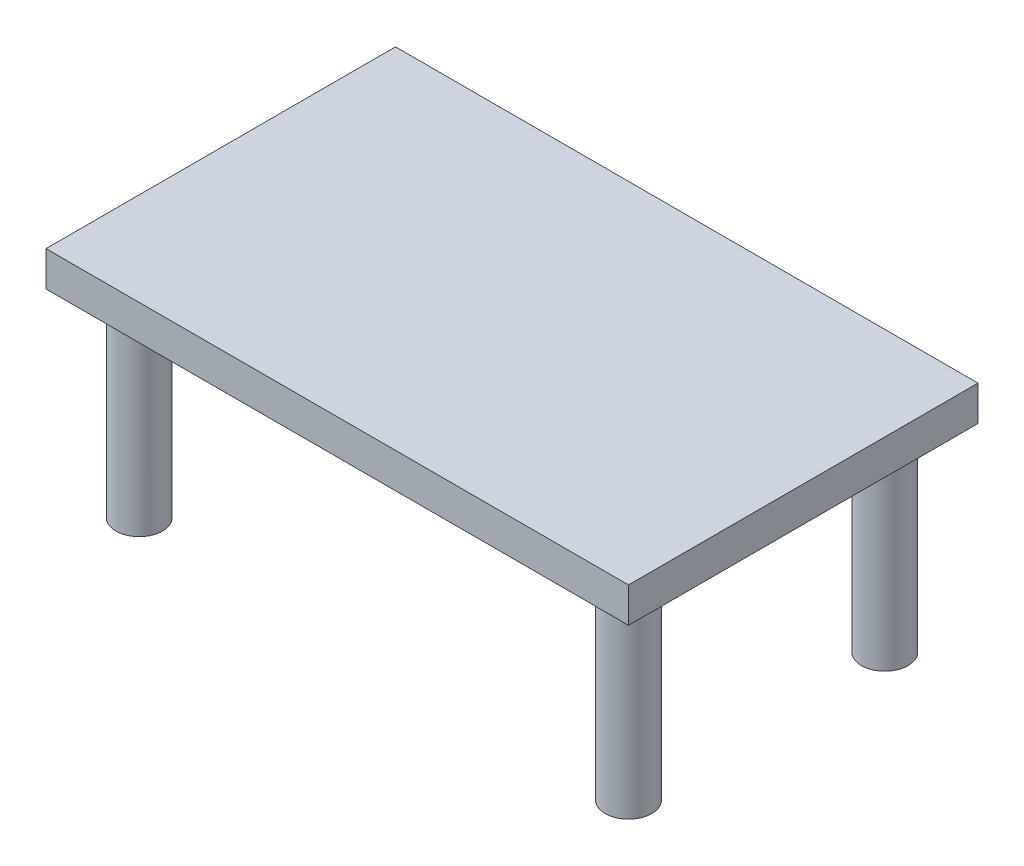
SolidWorks part; units mm, degrees
ref_plane "正面" through (0, 0, 0) normal (0, 0, 1) x (1, 0, 0)
ref_plane "平面" through (0, 0, 0) normal (0, 1, 0) x (1, 0, 0)
ref_plane "右側面" through (0, 0, 0) normal (1, 0, 0) x (0, 0, -1)
ref_plane "平面1" through (0, 200, 0) normal (0, 1, 0) x (-1, 0, 0)
sketch "ｽｹｯﾁ1" plane through (0, 200, 0) normal (0, 1, 0) x (-1, 0, 0)
  line L0 (-250, 150) -> (250, -150) construction
  line L1 (-250, -150) -> (250, -150)
  line L2 (-250, -150) -> (-250, 150)
  line L3 (-250, 150) -> (250, 150)
  line L4 (250, -150) -> (250, 150)
  dimension "D1" = 300
  dimension "D2" = 500
extrude "押し出し1" add sketch "ｽｹｯﾁ1" against normal blind 30
sketch "ｽｹｯﾁ2" plane through (0, 170, 0) normal (0, -1, 0) x (1, 0, 0)
  line L0 (-250, 150) -> (250, 150) construction
  line L1 (-250, -150) -> (-250, 150) construction
  circle A0 centre (-210, 110) radius 20
  dimension "D3" = 40
  dimension "D1" = 40
  dimension "D2" = 40
extrude "押し出し2" add sketch "ｽｹｯﾁ2" along normal up to surface (170 mm away)
mirror "ﾐﾗｰ1" about plane through (0, 0, 0) normal (1, 0, 0) of "押し出し2"
mirror "ﾐﾗｰ2" about plane through (0, 0, 0) normal (0, 0, 1) of "ﾐﾗｰ1", "押し出し2"
